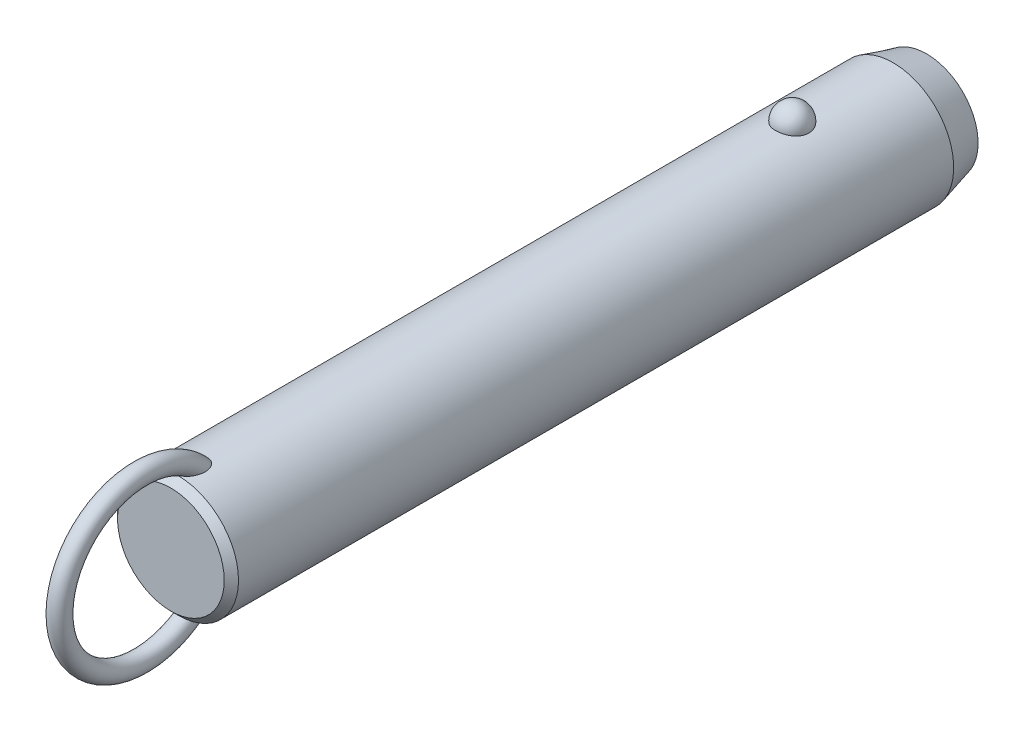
SolidWorks part; units mm, degrees
ref_plane "Front Plane" through (0, 0, 0) normal (0, 0, 1) x (1, 0, 0)
ref_plane "Top Plane" through (0, 0, 0) normal (0, 1, 0) x (1, 0, 0)
ref_plane "Right Plane" through (0, 0, 0) normal (1, 0, 0) x (0, 0, -1)
sketch "Sketch2" plane through (0, 0, 0) normal (0, 0, 1) x (1, 0, 0)
  circle A0 centre (0, 0) radius 12.7
  point P3 (0, 12.7)
  dimension "D1" = 25.4
extrude "Boss-Extrude1" add sketch "Sketch2" along normal blind 114.3
sketch "Sketch3" plane through (0, 0, 0) normal (0, 0, -1) x (-1, 0, 0)
  circle A0 centre (0, 0) radius 12.7
  dimension "D1" = 25.4
extrude "Boss-Extrude2" add sketch "Sketch3" along normal blind 31.7
chamfer "Chamfer1" distance 7 angle 15 1 edges at (-12.7, 0, -31.7)
sketch "Sketch12" plane through (0, 0, 0) normal (1, 0, 0) x (0, 0, -1)
  line L0 (-114.3, 12.7) -> (-114.3, -12.7) construction
  point P0 (-114.3, 0)
sketch "Sketch13" plane through (0, 0, 0) normal (1, 0, 0) x (0, 0, -1)
  circle A0 centre (-133.35, 0) radius 19.05
  point P2 (-114.3, 0)
  dimension "D1" = 38.1
sketch "Sketch14" plane through (0, 0, 0) normal (0, 1, 0) x (1, 0, 0)
  circle A0 centre (0, -116.3) radius 2
  point P2 (0, -114.3)
  dimension "D1" = 4
sweep "Sweep1" add profiles "Sketch14" path "Sketch13"
sketch "Sketch15" plane through (0, 0, 114.3) normal (0, 0, 1) x (1, 0, 0)
  circle A0 centre (0, 0) radius 12.7
  dimension "D1" = 25.4
extrude "Boss-Extrude3" add sketch "Sketch15" along normal blind 12.7
chamfer "Chamfer2" distance 1.5 angle 45 1 edges at (12.7, 0, 127)
sketch "Sketch18" plane through (0, 0, 0) normal (1, 0, 0) x (0, 0, -1)
  line L0 (24.7, 12.7) -> (-119.151, 12.7) construction
  line L1 (3.5, 16.2) -> (3.5, 9.2)
  line L2 (-119.151, -12.7) -> (24.7, -12.7) construction
  arc A0 (3.5, 16.2) -> (3.5, 9.2) centre (3.5, 12.7) ccw
  point P4 (0, 12.7)
  dimension "D1" = 28.9
revolve "Revolve1" add sketch "Sketch18" angle 360 about L1
